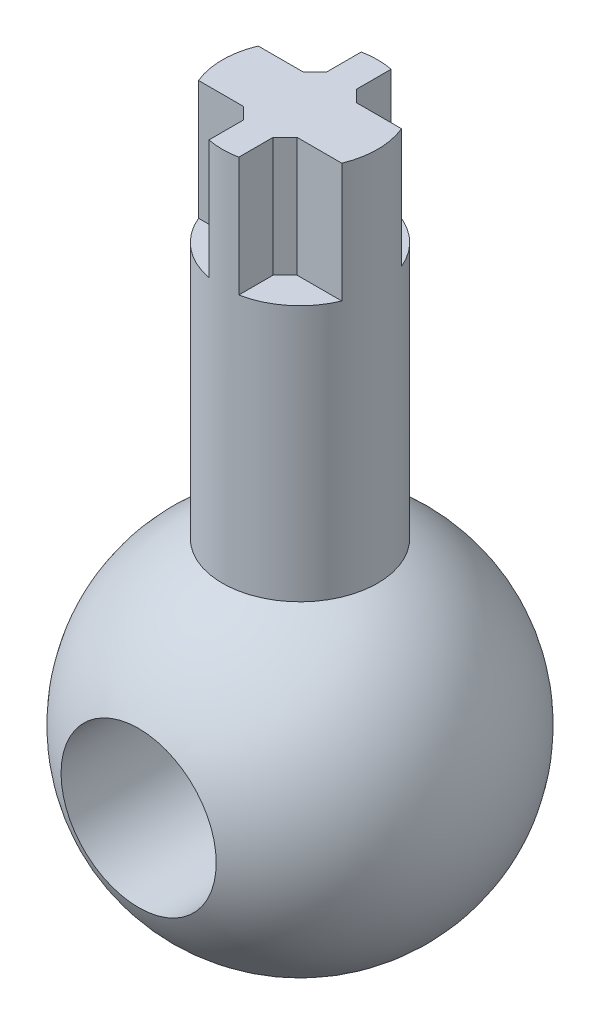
SolidWorks part; units mm, degrees
ref_plane "Plane1" through (0, 0, 0) normal (0, 0, 1) x (1, 0, 0)
ref_plane "Plane2" through (0, 0, 0) normal (0, 1, 0) x (1, 0, 0)
ref_plane "Plane3" through (0, 0, 0) normal (1, 0, 0) x (0, 0, -1)
sketch "s1" plane through (0, 0, 0) normal (0, 0, 1) x (1, 0, 0)
  line L0 (-56.6721, 0) -> (83.8972, 0) construction
  line L1 (-15, 0) -> (15, 0)
  arc A0 (15, 0) -> (-15, 0) centre (0, 0) ccw
  dimension "D1" = 15
revolve "1" add sketch "s1" angle 360 about L0
sketch "s2" plane through (0, 0, 0) normal (0, 1, 0) x (1, 0, 0)
  circle A0 centre (0, 0) radius 6.5
  dimension "D1" = 13
extrude "2" add sketch "s2" along normal blind 45
sketch "s3" plane through (0, 45, 0) normal (0, 1, 0) x (-1, 0, 0)
  line L0 (-10.6288, 0) -> (13.9677, 0) construction
  line L1 (56.6721, 0) -> (-83.8972, 0) construction
  line L2 (0, -10.8514) -> (0, 14.1903) construction
  line L3 (-1.25, -6.3787) -> (-1.25, -2.5)
  line L4 (1.25, -6.3787) -> (1.25, -2.5)
  line L5 (-6, 2.5) -> (-1.25, 2.5)
  line L6 (-6, -2.5) -> (-1.25, -2.5)
  line L7 (-1.25, 2.5) -> (-1.25, 6.3787)
  line L8 (1.25, 2.5) -> (1.25, 6.3787)
  line L9 (1.25, -2.5) -> (6, -2.5)
  line L10 (1.25, 2.5) -> (6, 2.5)
  circle A0 centre (0, 0) radius 6.5 construction
  arc A1 (-6, -2.5) -> (-1.25, -6.3787) centre (0, 0) ccw
  arc A2 (6, 2.5) -> (1.25, 6.3787) centre (0, 0) ccw
  arc A3 (-1.25, 6.3787) -> (-6, 2.5) centre (0, 0) ccw
  arc A4 (1.25, -6.3787) -> (6, -2.5) centre (0, 0) ccw
  dimension "D1" = 5
  dimension "D2" = 2.5
extrude "3" cut sketch "s3" against normal blind 10
chamfer "4" distance 1 angle 45 4 edges at (-1.25, 40, -2.5) (1.25, 40, -2.5) (1.25, 40, 2.5) (-1.25, 40, 2.5)
sketch "s5" plane through (0, 0, 0) normal (0, 0, 1) x (1, 0, 0)
  circle A0 centre (0, 0) radius 6.5
  dimension "D1" = 13
extrude "5" cut sketch "s5" against normal through all and the other way through all
fillet "Fillet1" [suppressed] radius 1.5
